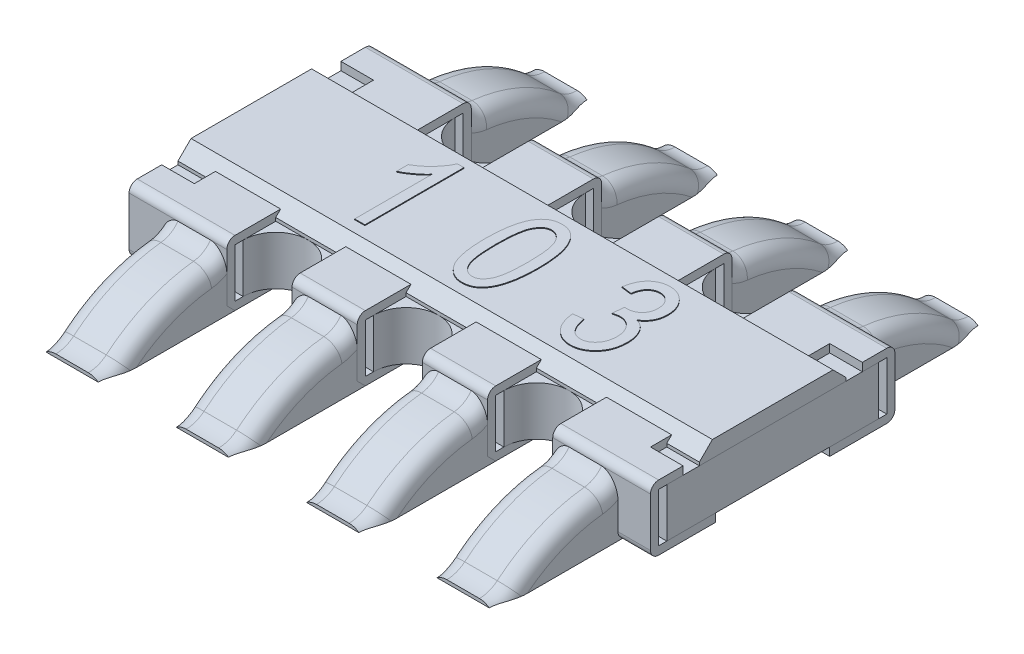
SolidWorks part; units mm, degrees
ref_plane "Front Plane" through (0, 0, 0) normal (0, 0, 1) x (1, 0, 0)
ref_plane "Top Plane" through (0, 0, 0) normal (0, 1, 0) x (1, 0, 0)
ref_plane "Right Plane" through (0, 0, 0) normal (1, 0, 0) x (0, 0, -1)
sketch "Sketch5" plane through (0, 0, 0) normal (1, 0, 0) x (0, 0, -1)
  line L0 (55, 0) -> (-55, 0) construction
  line L1 (-0.7, 0.4) -> (0.7, 0.4)
  line L2 (-0.75, 0.35) -> (-0.75, 0.05)
  line L3 (-0.7, 0) -> (-0.35, 0)
  line L4 (0.75, 0.35) -> (0.75, 0.05)
  line L5 (0, 55) -> (0, -55) construction
  line L8 (0.35, 0) -> (0.7, 0)
  arc A0 (0.7, 0.4) -> (0.75, 0.35) centre (0.7, 0.35) cw
  arc A1 (0.7, 0) -> (0.75, 0.05) centre (0.7, 0.05) ccw
  arc A2 (-0.75, 0.05) -> (-0.7, 0) centre (-0.7, 0.05) ccw
  arc A3 (-0.7, 0.4) -> (-0.75, 0.35) centre (-0.7, 0.35) ccw
  point P10 (0.75, 0.4)
  point P13 (0.75, 0)
  point P18 (-0.75, 0.4)
  dimension "D4" = 0.05
  dimension "D1" = 0.4
  dimension "D2" = 1.5
  dimension "D3" = 0.75
  dimension "D5" = 0.4
  dimension "D6" = 0.4
extrude "Extrude-Thin1" add sketch "Sketch5" along normal mid plane 3.2 thin
sketch "Sketch6" plane through (0, 0.4, 0) normal (0, 1, 0) x (1, 0, 0)
  line L1 (1.6, 0.75) -> (-1.6, 0.75) construction
  line L2 (-1, 0.75) -> (-0.6, 0.75)
  line L3 (-1, 0.75) -> (-1, 0.25)
  line L4 (-1, 0.25) -> (-0.6, 0.25)
  line L6 (-0.6, 0.75) -> (-0.6, 0.25)
  line L7 (0, -0.22) -> (0, 0.22) construction
  line L8 (-0.2, 0.75) -> (0.2, 0.75)
  line L9 (-0.2, 0.75) -> (-0.2, 0.25)
  line L10 (-0.2, 0.25) -> (0.2, 0.25)
  line L11 (0.2, 0.75) -> (0.2, 0.25)
  line L12 (0.6, 0.75) -> (1, 0.75)
  line L13 (0.6, 0.75) -> (0.6, 0.25)
  line L14 (0.6, 0.25) -> (1, 0.25)
  line L15 (1, 0.75) -> (1, 0.25)
  line L16 (1.6, 0.7) -> (1.6, -0.7) construction
  line L18 (1.6, -0.75) -> (-1.6, -0.75) construction
  line L19 (-1, -0.75) -> (-0.6, -0.75)
  line L20 (-1, -0.75) -> (-1, -0.25)
  line L21 (-1, -0.25) -> (-0.6, -0.25)
  line L22 (-0.6, -0.75) -> (-0.6, -0.25)
  line L24 (-0.2, -0.75) -> (0.2, -0.75)
  line L25 (-0.2, -0.75) -> (-0.2, -0.25)
  line L26 (-0.2, -0.25) -> (0.2, -0.25)
  line L27 (0.2, -0.75) -> (0.2, -0.25)
  line L28 (0.6, -0.75) -> (1, -0.75)
  line L29 (0.6, -0.75) -> (0.6, -0.25)
  line L30 (0.6, -0.25) -> (1, -0.25)
  line L31 (1, -0.75) -> (1, -0.25)
  dimension "D1" = 0.5
  dimension "D2" = 0.4
  dimension "D3" = 0.8
  dimension "D4" = 0.2
  dimension "D5" = 0.8
  dimension "D6" = 0.4
  dimension "D7" = 0.4
  dimension "D8" = 0.6
extrude "Cut-Extrude3" cut sketch "Sketch6" against normal through all
sketch "Sketch7" plane through (0, 0.4, 0) normal (0, 1, 0) x (1, 0, 0)
  line L0 (-1.6, 0.7) -> (-1.6, -0.7) construction
  line L1 (-1.6, -0.55) -> (-1.4, -0.55)
  line L2 (-1.6, -0.55) -> (-1.6, 0.55)
  line L3 (-1.6, 0.55) -> (-1.4, 0.55)
  line L4 (-1.4, -0.55) -> (-1.4, 0.55)
  line L5 (1.6, 0.7) -> (1.6, -0.7) construction
  line L6 (1.6, -0.55) -> (1.4, -0.55)
  line L7 (1.6, -0.55) -> (1.6, 0.55)
  line L8 (1.6, 0.55) -> (1.4, 0.55)
  line L9 (1.4, -0.55) -> (1.4, 0.55)
  line L12 (-0.22, 0) -> (0.22, 0) construction
  dimension "D1" = 0.55
  dimension "D2" = 1.1
  dimension "D3" = 0.2
extrude "Cut-Extrude4" cut sketch "Sketch7" against normal blind 0.1
sketch "Sketch1" plane through (0, 0.05, 0) normal (0, 1, 0) x (1, 0, 0)
  line L0 (-1.6, -0.65) -> (1.6, 0.65) construction
  line L1 (-1.6, 0.65) -> (1.6, 0.65)
  line L2 (-1.6, 0.65) -> (-1.6, -0.65)
  line L3 (-1.6, -0.65) -> (1.6, -0.65)
  line L4 (1.6, 0.65) -> (1.6, -0.65)
  line L5 (-1.2, 0.65) -> (-1.2, -0.65) construction
  line L6 (-1.6, 0.45) -> (1.6, 0.45) construction
  line L7 (-0.4, 0.65) -> (-0.4, -0.65) construction
  line L8 (-1.6, -0.45) -> (1.6, -0.45) construction
  line L9 (0.4, 0.65) -> (0.4, -0.65) construction
  line L10 (0, -0.22) -> (0, 0.22) construction
  line L11 (1.2, 0.65) -> (1.2, -0.65) construction
  dimension "D3" = 0.2
  dimension "D1" = 3.2
  dimension "D2" = 1.3
  dimension "D4" = 0.2
  dimension "D5" = 0.8
  dimension "D6" = 0.8
  dimension "D7" = 0.8
  dimension "D8" = 0.4
extrude "Boss-Extrude3" add sketch "Sketch1" along normal blind 0.3 separate body
sketch "Sketch9" plane through (0, 0.35, 0) normal (0, 1, 0) x (1, 0, 0)
  line L1 (-1.6, 0.45) -> (1.6, 0.45)
  line L2 (-1.6, 0.45) -> (-1.6, -0.45)
  line L3 (-1.6, -0.45) -> (1.6, -0.45)
  line L4 (1.6, 0.45) -> (1.6, -0.45)
extrude "Boss-Extrude4" add sketch "Sketch9" along normal blind 0.1
chamfer "Chamfer1" distance 0.08 angle 45 2 edges at (0, 0.45, 0.45) (0, 0.45, -0.45)
sketch "Sketch10" plane through (0, 0.05, 0) normal (0, 1, 0) x (1, 0, 0)
  line L0 (-1.6, 0.65) -> (1.6, 0.65) construction
  line L1 (-1.6, -0.65) -> (1.6, -0.65) construction
  line L2 (0, -0.2475) -> (0, 0.2475) construction
  circle A0 centre (-0.8, 0.65) radius 0.2
  circle A1 centre (0, 0.65) radius 0.2
  circle A2 centre (0.8, 0.65) radius 0.2
  circle A3 centre (0.8, -0.65) radius 0.2
  circle A4 centre (0, -0.65) radius 0.2
  circle A5 centre (-0.8, -0.65) radius 0.2
  dimension "D3" = 0.4
  dimension "D1" = 0.8
  dimension "D2" = 0.8
extrude "Cut-Extrude7" cut sketch "Sketch10" along normal blind 5
sketch "Sketch11" plane through (0, 0.45, 0) normal (0, 1, 0) x (1, 0, 0)
  line L0 (0, -0.2475) -> (0, 0.2475) construction
  line L2 (-0.2475, 0) -> (0.2475, 0) construction
  text T0 "1 0 3" font "Arial Narrow" height 0.6
  dimension "D1" = 0.86
  dimension "D2" = 0.3
extrude "Boss-Extrude5" add sketch "Sketch11" along normal blind 0.005
ref_plane "Plane1" through (-1.2, 0, 0) normal (1, 0, 0) x (0, 0, -1)
sketch "Sketch12" plane through (-1.2, 0, 0) normal (1, 0, 0) x (0, 0, -1)
  line L0 (-0.75, 0.35) -> (-0.75, 0.05)
  line L1 (-0.75, 0.05) -> (-0.7, 0)
  line L2 (0.825, 0) -> (-0.825, 0) construction
  line L3 (-0.7, 0) -> (-1.5, 0)
  line L4 (-1.5, 0) -> (-1.5, 0.02)
  line L5 (0, 0.2475) -> (0, -0.2475) construction
  line L6 (0.75, 0.05) -> (0.7, 0)
  line L7 (0.7, 0) -> (1.5, 0)
  line L8 (1.5, 0) -> (1.5, 0.02)
  line L9 (0.75, 0.35) -> (0.75, 0.05)
  arc A0 (-0.75, 0.05) -> (-0.7, 0) centre (-0.7, 0.05) ccw construction
  arc A1 (-1.5, 0.02) -> (-1.3904, 0.06) centre (-1.5, 0.19) ccw
  arc A2 (-1.3904, 0.06) -> (-0.8548, 0.2894) centre (-0.746, -0.7047) cw
  arc A3 (-0.8548, 0.2894) -> (-0.75, 0.35) centre (-0.8711, 0.4385) ccw
  arc A4 (1.5, 0.02) -> (1.3904, 0.06) centre (1.5, 0.19) cw
  arc A5 (1.3904, 0.06) -> (0.8548, 0.2894) centre (0.746, -0.7047) ccw
  arc A6 (0.8548, 0.2894) -> (0.75, 0.35) centre (0.8711, 0.4385) cw
  dimension "D2" = 0.15
  dimension "D3" = 0.17
  dimension "D4" = 1
  dimension "D1" = 0.02
  dimension "D5" = 1.5
  dimension "D6" = 0.7047
  dimension "D7" = 1.5
extrude "Boss-Extrude6" add sketch "Sketch12" along normal mid plane 0.4 separate body
fillet "Fillet1" radius 0.1 6 edges at (-1.4, 0.3087, 0.796) (-1.4, 0.0303, 1.4417) (-1, 0.3087, 0.796) (-1, 0.0303, 1.4417) (-1.4, 0.2146, 1.1397) (-1, 0.2146, 1.1397)
fillet "Fillet2" radius 0.1 6 edges at (-1, 0.0303, -1.4417) (-1, 0.3087, -0.796) (-1.4, 0.0303, -1.4417) (-1.4, 0.3087, -0.796) (-1, 0.2146, -1.1397) (-1.4, 0.2146, -1.1397)
pattern_linear "LPattern3" count 4 spacing 0.8 along (1, 0, 0)
